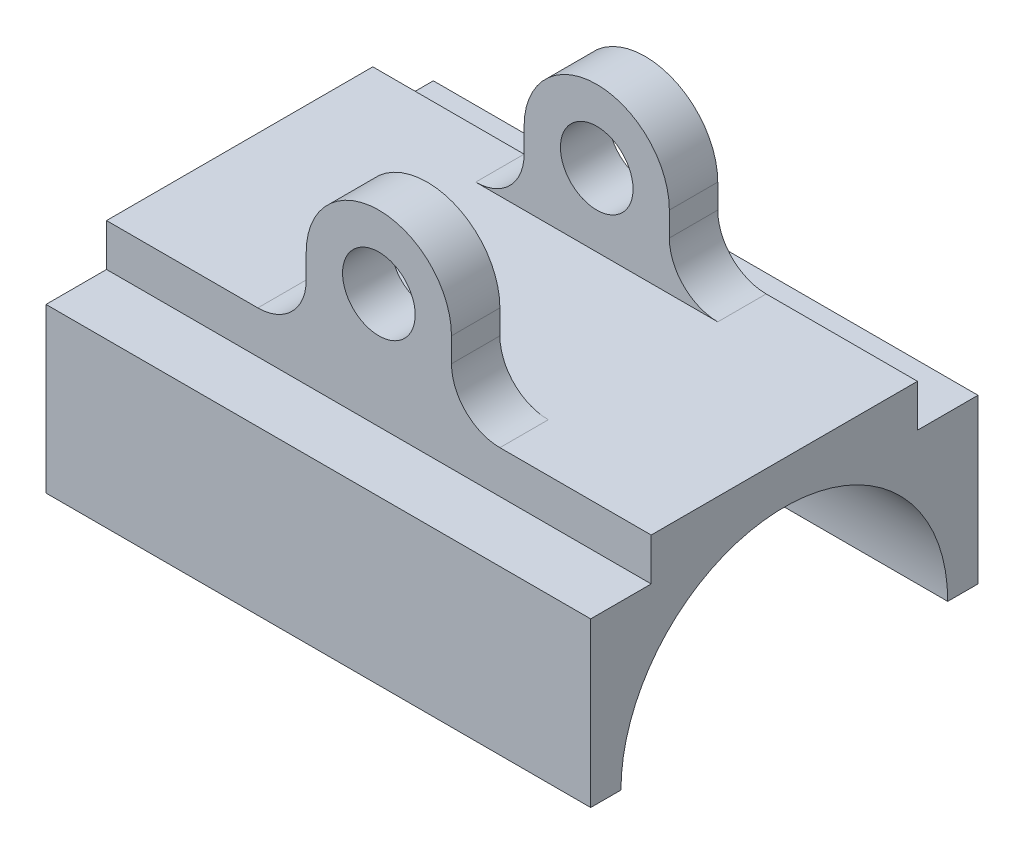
SolidWorks part; units mm, degrees
ref_plane "Front" through (0, 0, 0) normal (0, 0, 1) x (1, 0, 0)
ref_plane "Top" through (0, 0, 0) normal (0, 1, 0) x (1, 0, 0)
ref_plane "Right" through (0, 0, 0) normal (1, 0, 0) x (0, 0, -1)
sketch "Sketch1" plane through (0, 0, 0) normal (1, 0, 0) x (0, 0, -1)
  line L0 (-85.725, 0) -> (-101.6, 0)
  line L1 (-101.6, 0) -> (-101.6, 85.725)
  line L2 (-101.6, 85.725) -> (-69.85, 85.725)
  line L3 (-69.85, 85.725) -> (-69.85, 107.95)
  line L4 (-69.85, 107.95) -> (69.85, 107.95)
  line L5 (69.85, 107.95) -> (69.85, 85.725)
  line L6 (69.85, 85.725) -> (101.6, 85.725)
  line L7 (101.6, 85.725) -> (101.6, 0)
  line L8 (101.6, 0) -> (85.725, 0)
  arc A0 (-85.725, 0) -> (85.725, 0) centre (0, 0) cw
  dimension "D1" = 171.45
  dimension "D2" = 203.2
  dimension "D3" = 85.725
  dimension "D4" = 22.225
  dimension "D5" = 139.7
extrude "Base-Extrude" add sketch "Sketch1" against normal blind 285.75
sketch "Sketch2" plane through (0, 0, 69.85) normal (0, 0, 1) x (1, 0, 0)
  line L0 (-180.975, 107.95) -> (-180.975, 146.05)
  line L1 (-285.75, 107.95) -> (0, 107.95) construction
  line L2 (-104.775, 146.05) -> (-104.775, 107.95)
  line L3 (-104.775, 107.95) -> (-180.975, 107.95)
  line L4 (-142.875, 146.05) -> (-142.875, 0) construction
  line L5 (-285.75, 0) -> (0, 0) construction
  arc A0 (-180.975, 146.05) -> (-104.775, 146.05) centre (-142.875, 146.05) cw
  dimension "D1" = 38.1
  dimension "D2" = 38.1
extrude "Boss-Extrude1" add sketch "Sketch2" against normal blind 25.4
fillet "Fillet1" radius 25.4 4 edges
sketch "Sketch3" plane through (0, 0, 69.85) normal (0, 0, 1) x (1, 0, 0)
  circle A0 centre (-142.875, 146.05) radius 19.05
  dimension "D1" = 38.1
extrude "Cut-Extrude1" cut sketch "Sketch3" against normal up to surface (25.4 mm away)
mirror "Mirror1" about plane through (0, 0, 0) normal (0, 0, 1) of "Boss-Extrude1", "Fillet1", "Cut-Extrude1"
